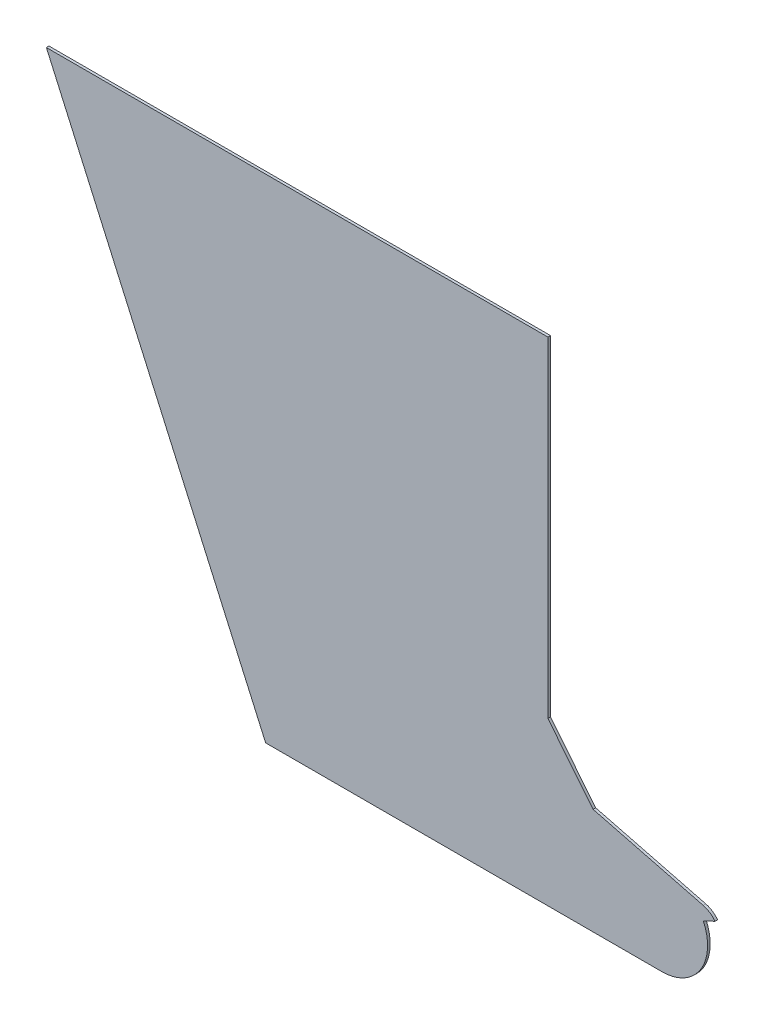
SolidWorks part; units mm, degrees
ref_plane "Front Plane" through (0, 0, 0) normal (0, 0, 1) x (1, 0, 0)
ref_plane "Top Plane" through (0, 0, 0) normal (0, 1, 0) x (1, 0, 0)
ref_plane "Right Plane" through (0, 0, 0) normal (1, 0, 0) x (0, 0, -1)
sketch "Sketch1" plane through (0, 0, 0) normal (0, 0, 1) x (1, 0, 0)
  line L0 (1162.9117, -885.406) -> (1162.9117, -1697.9129)
  line L1 (1579.8079, -1921.8289) -> (1545.2776, -1937.9307) construction
  line L2 (1162.9117, -1697.9129) -> (1274.112, -1835.8935)
  line L3 (1274.112, -1835.8935) -> (1544.7861, -1905.0356)
  line L4 (468.6154, -2097.1216) -> (1443.8617, -2097.1216)
  line L5 (1574.0529, -1924.5125) -> (1545.2776, -1937.9307)
  line L6 (1169.2617, -885.406) -> (1143.8617, -885.406) construction
  line L7 (1443.8617, -2097.1216) -> (443.8617, -2097.1216) construction
  line L8 (468.6154, -2097.1216) -> (-70.773, -885.406)
  line L9 (-70.773, -885.406) -> (1162.9117, -885.406)
  line L10 (443.8617, -2135.2216) -> (1443.8617, -2135.2216) construction
  line L11 (461.6646, -2097.1216) -> (-301.5354, -382.6216) construction
  line L13 (1169.2617, -885.406) -> (1169.2617, -1698.206) construction
  line L14 (1473.5271, -2073.214) -> (1173.5271, -1700.9652) construction
  line L15 (1554.7072, -1901.016) -> (1327.0668, -1842.8666) construction
  arc A0 (1545.2776, -1937.9307) -> (1443.8617, -2097.1216) centre (1443.8617, -1985.2216) cw
  arc A2 (1544.7861, -1905.0356) -> (1574.0529, -1924.5125) centre (1531.6329, -1956.5273) cw
  dimension "D4" = 6.35
  dimension "D5" = 53.1451
  dimension "D1" = 6.35
  dimension "D2" = 6.35
  dimension "D3" = 6.35
  dimension "D6" = 6.35
extrude "Boss-Extrude1" add sketch "Sketch1" along normal blind 6.35
